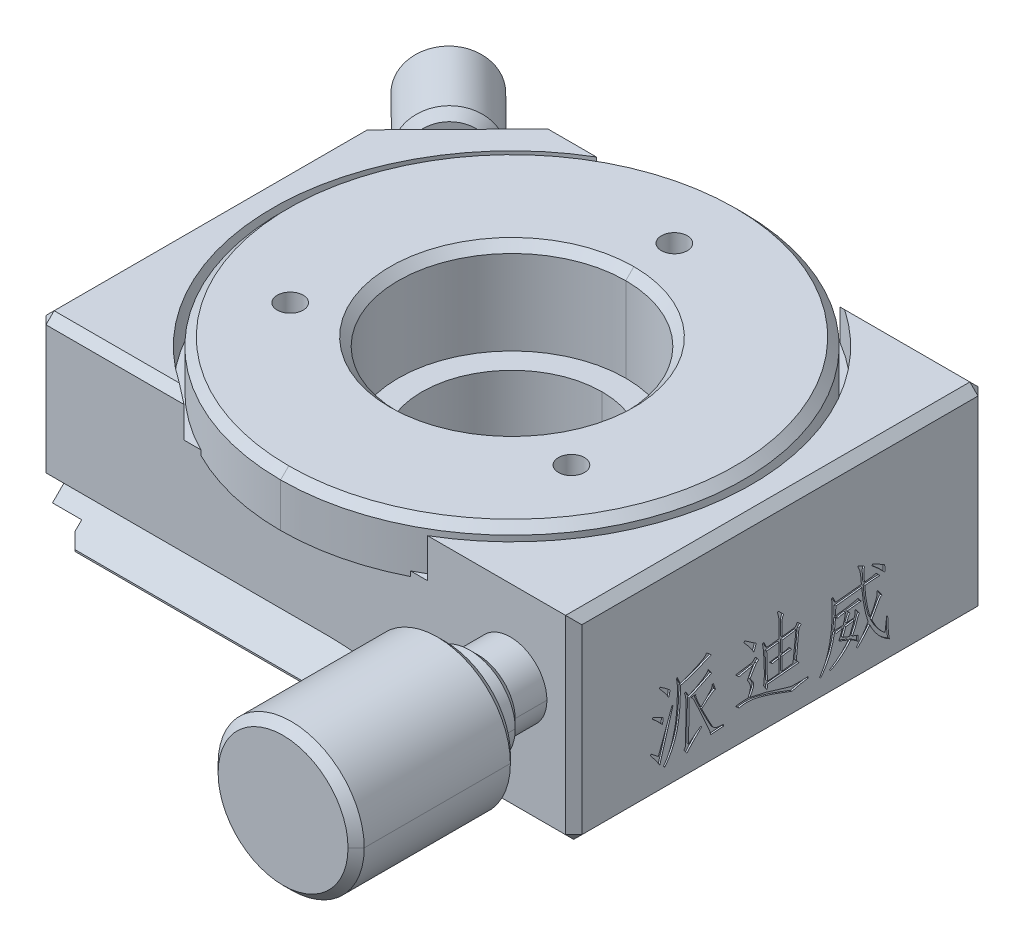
SolidWorks part; units mm, degrees
ref_plane "前视基准面" through (0, 0, 0) normal (0, 0, 1) x (1, 0, 0)
ref_plane "上视基准面" through (0, 0, 0) normal (0, 1, 0) x (1, 0, 0)
ref_plane "右视基准面" through (0, 0, 0) normal (1, 0, 0) x (0, 0, -1)
imported_body "输入1"
sketch "草图2" plane through (0, 12.7, 0) normal (0, 1, 0) x (1, 0, 0)
  arc A0 (0, -7.5072) -> (0, 7.5072) centre (0, 0) ccw construction
  arc A1 (0, 7.5072) -> (0, -7.5072) centre (0, 0) ccw construction
  arc A2 (0, 13.75) -> (0, -13.75) centre (0, 0) ccw
  arc A3 (0, -13.75) -> (0, 13.75) centre (0, 0) ccw
  arc A4 (0, 13.75) -> (0, -13.75) centre (0, 0) ccw
  arc A5 (0, -13.75) -> (0, 13.75) centre (0, 0) ccw
  arc A6 (0, -7.5072) -> (0, 7.5072) centre (0, 0) ccw
  arc A7 (0, 7.5072) -> (0, -7.5072) centre (0, 0) ccw
  dimension "D1" = 0
extrude "凸台-拉伸1" add sketch "草图2" against normal blind 2
sketch "草图3" plane through (0, 12.7, 0) normal (0, 1, 0) x (1, 0, 0)
  circle A0 centre (0, 0) radius 10 construction
  dimension "D1" = 20
hole_wizard "M2 螺纹孔1" positions "草图4" profile "草图5" tap size "M2" standard "GB"
sketch "草图4" plane through (0, 12.7, 0) normal (0, 1, 0) x (1, 0, 0)
  circle A0 centre (0, 0) radius 10 construction
  point P0 (0, 10)
sketch "草图5" plane through (0, 12.7, -10) normal (1, 0, 0) x (0, 0, 1)
  line L0 (0, 0) -> (0, 5.6807)
  line L1 (0, 5.6807) -> (0.8, 5.2)
  line L2 (0.8, 5.2) -> (0.8, 0)
  line L5 (0.8, 0) -> (0, 0)
  line L10 (0, 5.6807) -> (-0.8, 5.2) construction
  line L11 (0, -6.35) -> (0, 107.95) construction
  dimension "螺纹孔钻头直径" = 1.6
  dimension "螺纹孔钻头深度" = 5.2
  dimension "导头角度" = 118
pattern_circular "阵列(圆周)1" count 3 over 360 about axis through (0, 0, 0) along (0, 1, 0) of "M2 螺纹孔1"
sketch "草图6" plane through (16.5, 0, 0) normal (1, 0, 0) x (0, 0, -1)
  line L0 (-8.3854, 2.0318) -> (9.7776, 2.0318) construction
  text T0 "派迪威"
extrude "切除-拉伸1" cut sketch "草图6" against normal blind 0.1
hole_wizard "M4 螺纹孔1" positions "草图7" profile "草图8" tap size "M4" standard "GB"
sketch "草图7" plane through (-16.5, 0, 0) normal (-1, 0, 0) x (0, 0, 1)
  line L0 (0, 0) -> (0, 7) construction
  line L1 (10, 12.7) -> (-10, 12.7) construction
  point P0 (0, 4.7)
  dimension "D1" = 8
sketch "草图8" plane through (-16.5, 4.7, 0) normal (0, 1, 0) x (0, 0, 1)
  line L0 (0, 0) -> (0, 11.0914)
  line L1 (0, 11.0914) -> (1.65, 10.1)
  line L2 (1.65, 10.1) -> (1.65, 0)
  line L5 (1.65, 0) -> (0, 0)
  line L10 (0, 11.0914) -> (-1.65, 10.1) construction
  line L11 (0, -6.35) -> (0, 107.95) construction
  dimension "螺纹孔钻头直径" = 3.3
  dimension "螺纹孔钻头深度" = 10.1
  dimension "导头角度" = 118
